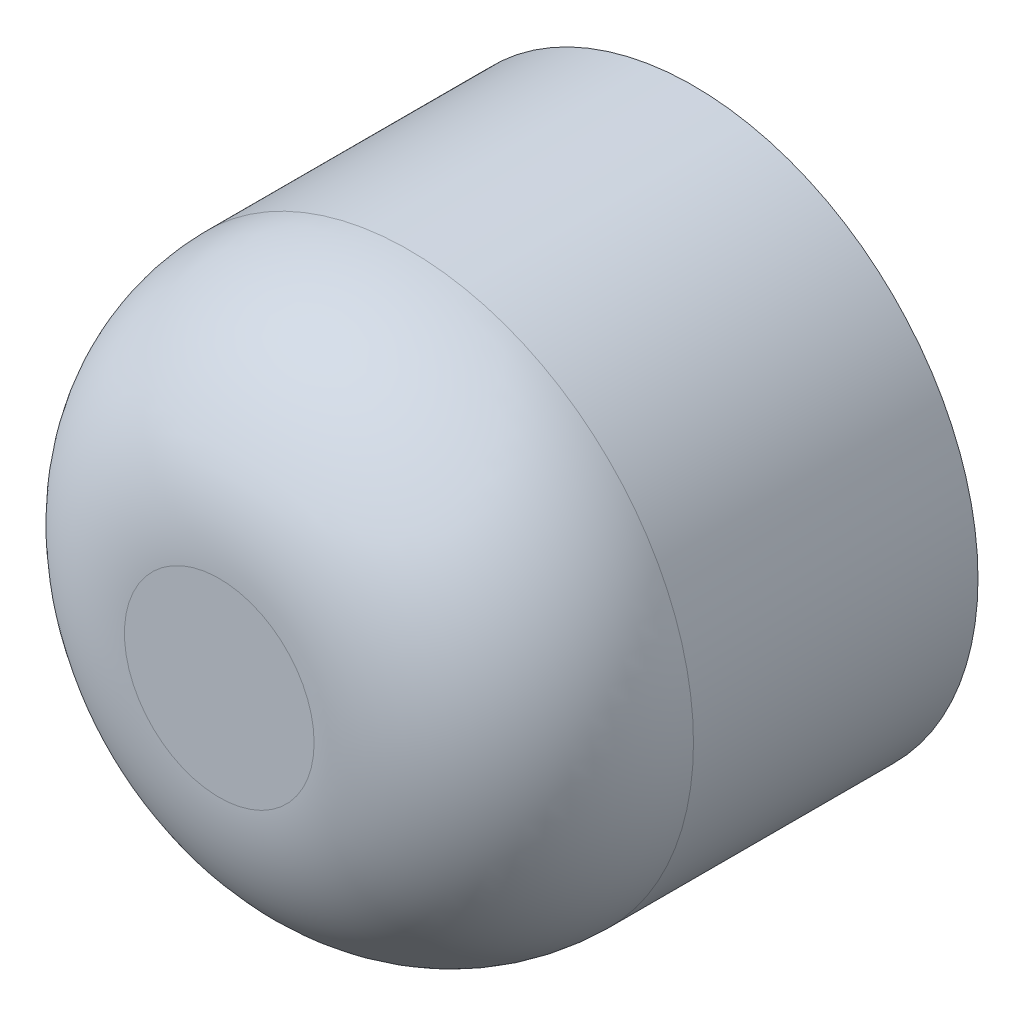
SolidWorks part; units mm, degrees
ref_plane "Plan de face" through (0, 0, 0) normal (0, 0, 1) x (1, 0, 0)
ref_plane "Plan de dessus" through (0, 0, 0) normal (0, 1, 0) x (1, 0, 0)
ref_plane "Plan de droite" through (0, 0, 0) normal (1, 0, 0) x (0, 0, -1)
sketch "Esquisse1" plane through (0, 0, 0) normal (0, 0, 1) x (1, 0, 0)
  circle A0 centre (0, 0) radius 6
  dimension "D1" = 12
extrude "Boss.-Extru.1" add sketch "Esquisse1" along normal blind 10
fillet "Congé1" radius 4 1 edges at (6, 0, 10)
